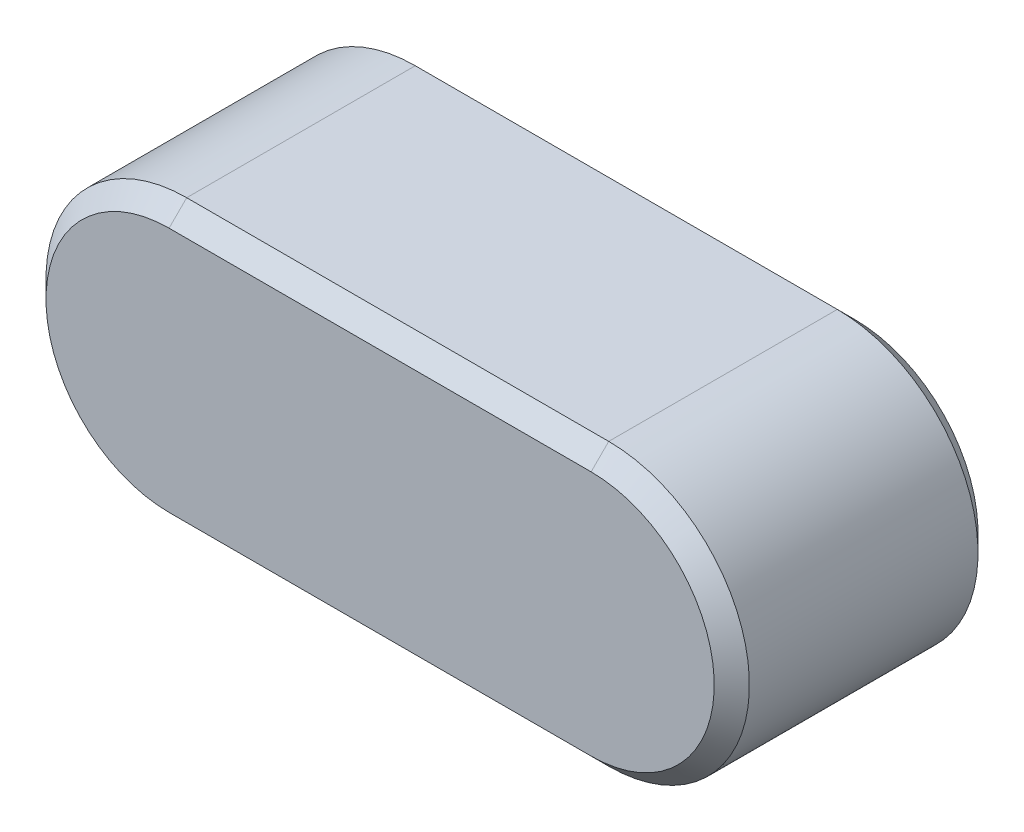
SolidWorks part; units mm, degrees
ref_plane "Face" through (0, 0, 0) normal (0, 0, 1) x (1, 0, 0)
ref_plane "Dessus" through (0, 0, 0) normal (0, 1, 0) x (1, 0, 0)
ref_plane "Droite" through (0, 0, 0) normal (1, 0, 0) x (0, 0, -1)
sketch "Esquisse1" plane through (0, 0, 0) normal (0, 0, 1) x (1, 0, 0)
  line L0 (-23.841, 0) -> (-11.841, 0) construction
  line L1 (-23.841, 4) -> (-11.841, 4)
  line L2 (-23.841, -4) -> (-11.841, -4)
  arc A0 (-23.841, 4) -> (-23.841, -4) centre (-23.841, 0) ccw
  arc A1 (-11.841, -4) -> (-11.841, 4) centre (-11.841, 0) ccw
  point P3 (-17.841, 0)
  dimension "D1" = 8
  dimension "D2" = 12
extrude "Boss.-Extru.1" add sketch "Esquisse1" along normal blind 7.5
chamfer "Chanfrein1" distance 0.5 angle 45 8 edges at (-17.841, -4, 7.5) (-7.841, 0, 7.5) (-27.841, 0, 7.5) (-17.841, 4, 7.5) (-17.841, -4, 0) (-7.841, 0, 0) (-27.841, 0, 0) (-17.841, 4, 0)
